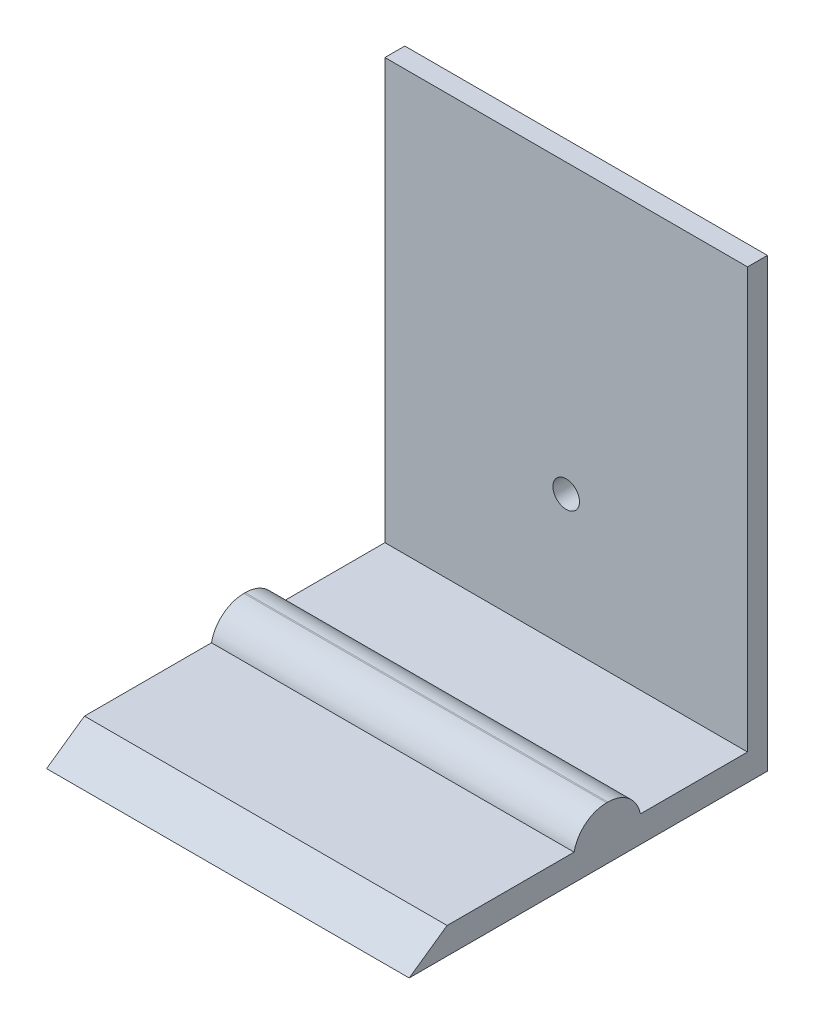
SolidWorks part; units mm, degrees
ref_plane "Front Plane" through (0, 0, 0) normal (0, 0, 1) x (1, 0, 0)
ref_plane "Top Plane" through (0, 0, 0) normal (0, 1, 0) x (1, 0, 0)
ref_plane "Right Plane" through (0, 0, 0) normal (1, 0, 0) x (0, 0, -1)
body saved out of another part "Stock-V1-1"
move or copy body "Body-Move/Copy1" bodies to move or copy 101 copy no rotation origin (-85, 0, 105) rotation axis (0, 1, 0) rotation angle 180
